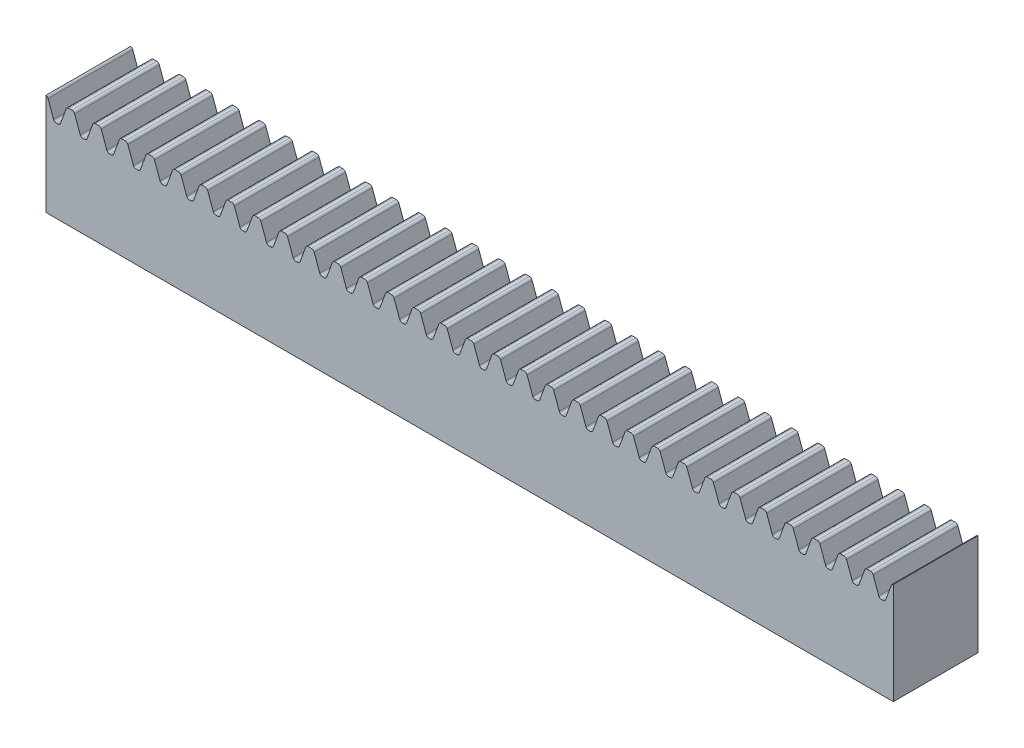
SolidWorks part; units mm, degrees
ref_plane "Front Plane" through (0, 0, 0) normal (0, 0, 1) x (1, 0, 0)
ref_plane "Top Plane" through (0, 0, 0) normal (0, 1, 0) x (1, 0, 0)
ref_plane "Right Plane" through (0, 0, 0) normal (1, 0, 0) x (0, 0, -1)
sketch "Sketch1" plane through (0, 0, 0) normal (0, 0, 1) x (1, 0, 0)
  line L0 (-50, 6) -> (-50, -6) construction
  line L1 (-50, -6) -> (50, -6) construction
  line L2 (50, -6) -> (50, 6) construction
  line L4 (0, 6) -> (0, -6) construction
  line L5 (-50, 5) -> (50, 5) construction
  line L6 (-47.5453, 6) -> (-46.7025, 6) construction
  line L7 (-46.7025, 6) -> (-45.8835, 3.75) construction
  line L8 (-47.5453, 6) -> (-48.3643, 3.75) construction
  line L9 (-48.3643, 3.75) -> (-45.8835, 3.75) construction
  line L10 (-47.1239, 6) -> (-47.1239, 3.75) construction
  line L11 (-50, 0) -> (-40.8407, 0) construction
  line L12 (50, 0) -> (40.8407, 0) construction
  point P15 (-43.9823, 6)
  point P16 (-15.5, -6)
  point P17 (-46.3385, 5)
  point P18 (-47.9093, 5)
  point P21 (-0.5, -6)
sketch "Sketch2" plane through (0, 0, 0) normal (1, 0, 0) x (0, 0, -1)
  line L0 (-5, 0) -> (5, 0) construction
  dimension "Face Width" = 10
sketch "Sketch3" plane through (0, 0, 0) normal (0, 0, 1) x (1, 0, 0)
  line L1 (-50, 6) -> (50, 6)
  line L2 (-50, 6) -> (-50, -6)
  line L3 (-50, -6) -> (50, -6)
  line L4 (50, 6) -> (50, -6)
extrude "Boss-Extrude1" add sketch "Sketch3" against normal up to vertex (5 mm away) and the other way up to vertex (5 mm away)
sketch "Sketch4" plane through (0, 0, 0) normal (0, 0, 1) x (1, 0, 0)
  line L0 (-47.1239, 6) -> (-43.9823, 6) construction
  line L9 (-45.5531, 6) -> (-45.5531, 3.75)
  line L10 (-45.5531, 3.75) -> (-45.8835, 3.75)
  line L11 (-45.8835, 3.75) -> (-46.7025, 6)
  line L12 (-46.7025, 6) -> (-45.5531, 6)
  line L13 (-47.5453, 6) -> (-48.3643, 3.75)
  line L14 (-48.3643, 3.75) -> (-48.6947, 3.75)
  line L15 (-48.6947, 3.75) -> (-48.6947, 6)
  line L16 (-48.6947, 6) -> (-47.5453, 6)
  line L17 (50, 6) -> (-50, 6) construction
  line L18 (-47.5453, 6) -> (-47.3104, 6)
  line L19 (-46.9374, 6) -> (-46.7025, 6)
  arc A0 (-48.5992, 3.75) -> (-48.2839, 3.9708) centre (-48.5992, 4.0855) ccw
  arc A1 (-45.9639, 3.9708) -> (-45.6486, 3.75) centre (-45.6486, 4.0855) ccw
  arc A2 (-47.6257, 5.7792) -> (-47.3104, 6) centre (-47.3104, 5.6645) cw
  arc A3 (-46.9374, 6) -> (-46.6221, 5.7792) centre (-46.9374, 5.6645) cw
extrude "Cut-Extrude1" cut sketch "Sketch4" against normal through all both and the other way through all contours L14 A0 L13 L16 L15 | L13 A2 L18 | L19 A3 L11 | L11 A1 L10 L9 L12
pattern_linear "LPattern1" count 32 spacing 3.1416 along (1, 0, 0) count 2 spacing 3.1416 along (-1, 0, 0) of "Cut-Extrude1"
sketch "Drawing Refernce 1" plane through (0, 0, 5) normal (0, 0, 1) x (1, 0, 0)
  line L0 (-50, 0) -> (50, 0) construction
  point P6 (-35, 0)
  point P7 (-27.5, 0)
  point P8 (35, 0)
equation "\"Diametral Pitch\"= 1 / \"Module\""
equation "\"Pressure Angle\"=20"
equation "\"Dedendum\"= 1.25 / \"Diametral Pitch\""
equation "\"Addendum\"= 1 / \"Diametral Pitch\""
equation "\"WorkingDepth\"= 2 / \"Diametral Pitch\""
equation "\"WholeDepth\"= 2.25 / \"Diametral Pitch\""
equation "\"Clearance\"= 0.25 / \"Diametral Pitch\""
equation "\"ToothThickness\"= ( pi / 2 ) / \"Diametral Pitch\""
equation "\"CircularPitch\"= pi / \"Diametral Pitch\""
equation "\"Fillet\"= \"Clearance\" * cos ( \"Pressure Angle\" ) * tan ( ( 90 + \"Pressure Angle\" ) / 2 )"
equation "\"Module\"= 1"
equation "\"Addendum@Sketch1\"=\"Addendum\""
equation "\"Pressure Angle@Sketch1\"=\"Pressure Angle\""
equation "\"Dedendum@Sketch1\"=\"Dedendum\""
equation "\"Circular Pitch@Sketch1\"=\"CircularPitch\""
equation "\"Circular Tooth Thickness@Sketch1\"=\"ToothThickness\""
equation "\"Module@Sketch1\"=\"Module\""
equation "\"Approximate Number of Teeth@Sketch1\" = int ( \"Length@Sketch1\" /  ( 2 * \"Circular Tooth Thickness@Sketch1\" )  ) "
equation "\"Rack Length@Sketch1\" = \"Circular Pitch@Sketch1\" *  ( \"Approximate Number of Teeth@Sketch1\" - 1 ) "
equation "\"D3@LPattern1\"=\"CircularPitch\""
equation "\"D1@LPattern1\"=\"Approximate Number of Teeth@Sketch1\"+1"
equation "\"D1@Sketch1\"=\"Circular Pitch@Sketch1\"*2"
equation "\"D1@Sketch4\"=\"Fillet\""
equation "\"D4@LPattern1\"=\"CircularPitch\""
equation "\"D2@Drawing Refernce 1\"=\"D1@Drawing Refernce 1\"*1.5"
equation "\"D3@Drawing Refernce 1\"=\"D1@Drawing Refernce 1\""
